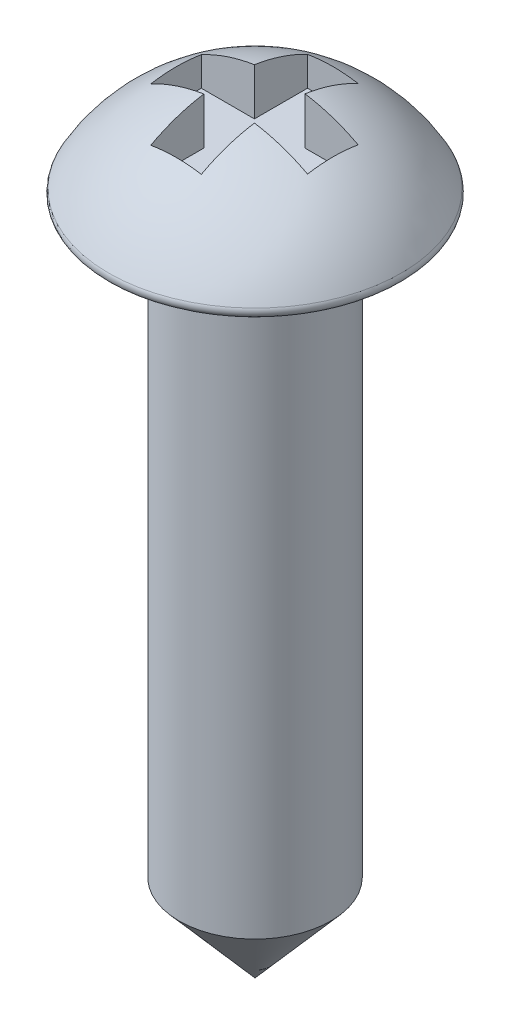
SolidWorks part; units mm, degrees
ref_plane "Plan de face" through (0, 0, 0) normal (0, 0, 1) x (1, 0, 0)
ref_plane "Plan de dessus" through (0, 0, 0) normal (0, 1, 0) x (1, 0, 0)
ref_plane "Plan de droite" through (0, 0, 0) normal (1, 0, 0) x (0, 0, -1)
sketch "Esquisse1" plane through (0, 0, 0) normal (0, 0, 1) x (1, 0, 0)
  line L0 (0, 3.8001) -> (0, -9.7655) construction
  line L1 (2.2, 0) -> (1.1, 0)
  line L2 (1.1, 0) -> (1.1, -8.5)
  line L3 (1.1, -8.5) -> (0, -9.7655)
  line L4 (0, -9.7655) -> (0, 1.393)
  arc A0 (2.2, 0) -> (0, 1.393) centre (0, -1.0408) ccw
  dimension "D1" = 1.1
  dimension "D2" = 8.5
  dimension "D3" = 2.2
revolve "Révolution1" add sketch "Esquisse1" angle 360 about L0
fillet "Congé1" radius 0.1 1 edges at (0, 0, 2.2)
ref_plane "Plan1" through (0, 1.1565, 0) normal (0, 1, 0) x (-1, 0, 0)
sketch "Esquisse2" plane through (0, 1.1565, 0) normal (0, 1, 0) x (-1, 0, 0)
  line L0 (0.0048, 1.1408) -> (0.0048, 0.0036) construction
  line L1 (-0.3619, 1.1408) -> (0.3716, 1.1408)
  line L2 (-0.3619, 1.1408) -> (-0.3619, 0.3704)
  line L3 (-0.3619, -1.1335) -> (0.3716, -1.1335)
  line L4 (0.3716, 1.1408) -> (0.3716, 0.3704)
  line L5 (-1.1323, 0.3704) -> (-0.3619, 0.3704)
  line L6 (-1.1323, 0.3704) -> (-1.1323, -0.3632)
  line L7 (-1.1323, -0.3632) -> (-0.3619, -0.3632)
  line L8 (1.142, 0.3704) -> (1.142, -0.3632)
  line L9 (0.0048, 0.0036) -> (0.0048, -1.1335) construction
  line L10 (1.142, 0.0036) -> (0.0048, 0.0036) construction
  line L11 (0.0048, 0.0036) -> (-1.1323, 0.0036) construction
  line L12 (0.3716, -0.3632) -> (1.142, -0.3632)
  line L13 (-0.3619, -0.3632) -> (-0.3619, -1.1335)
  line L14 (0.3716, 0.3704) -> (1.142, 0.3704)
  line L15 (0.3716, -0.3632) -> (0.3716, -1.1335)
extrude "Enlèv. mat.-Extru.1" cut sketch "Esquisse2" against normal mid plane 1
